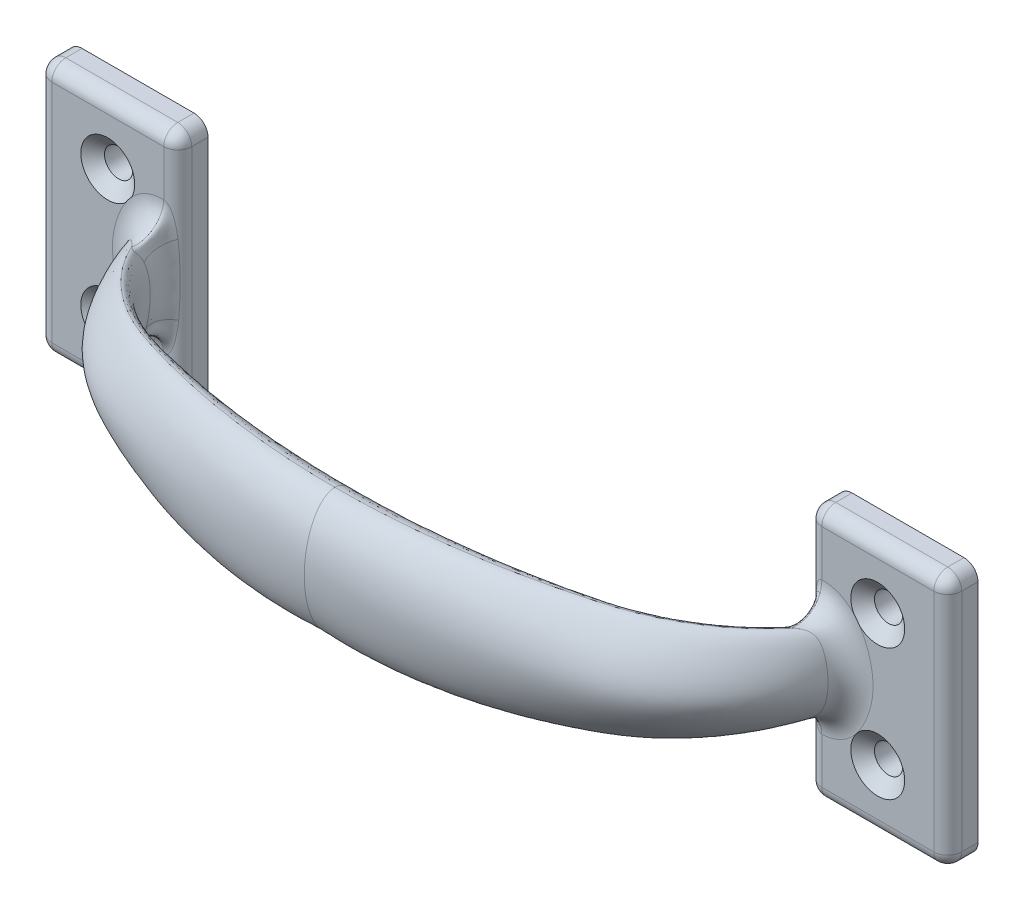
SolidWorks part; units mm, degrees
ref_plane "Front Plane" through (0, 0, 0) normal (0, 0, 1) x (1, 0, 0)
ref_plane "Top Plane" through (0, 0, 0) normal (0, 1, 0) x (1, 0, 0)
ref_plane "Right Plane" through (0, 0, 0) normal (1, 0, 0) x (0, 0, -1)
imported_body "Imported3"
sketch "Sketch1" plane through (0, 12.132, 0) normal (0, 1, 0) x (-1, 0, 0)
  line L0 (69.0098, 2.9464) -> (57.15, 2.9464)
  line L1 (59.69, 5.4864) -> (69.0098, 5.4864)
  line L2 (69.0098, 5.4864) -> (69.0098, 2.9464)
  arc A0 (57.15, 2.9464) -> (59.69, 5.4864) centre (59.69, 2.9464) cw
extrude "Boss-Extrude1" add sketch "Sketch1" along normal blind 10.8867
sketch "Sketch2" plane through (0, -12.1357, 0) normal (0, -1, 0) x (1, 0, 0)
  line L0 (-69.0098, 5.4864) -> (-59.69, 5.4864)
  line L1 (-57.15, 2.9464) -> (-69.0098, 2.9464)
  line L2 (-69.0098, 2.9464) -> (-69.0098, 5.4864)
  arc A0 (-59.69, 5.4864) -> (-57.15, 2.9464) centre (-59.69, 2.9464) cw
extrude "Boss-Extrude2" add sketch "Sketch2" along normal blind 10.8831
sketch "Sketch3" plane through (69.0091, 0, 0) normal (1, 0, 0) x (0, 0, -1)
  line L0 (-5.4864, -12.1357) -> (-5.4864, 12.132)
  line L1 (-5.4864, 12.132) -> (-2.9464, 12.132)
  line L2 (-2.9464, 12.132) -> (-2.9464, -12.1357)
  line L3 (-2.9464, -12.1357) -> (-5.4864, -12.1357)
extrude "Boss-Extrude3" add sketch "Sketch3" along normal blind 13.5409
sketch "Sketch4" plane through (0, -12.1357, 0) normal (0, -1, 0) x (1, 0, 0)
  line L0 (59.69, 5.4864) -> (82.55, 5.4864)
  line L1 (82.55, 5.4864) -> (82.55, 2.9464)
  line L2 (82.55, 2.9464) -> (57.15, 2.9464)
  arc A0 (57.15, 2.9464) -> (59.69, 5.4864) centre (59.69, 2.9464) cw
extrude "Boss-Extrude4" add sketch "Sketch4" along normal blind 10.8831
sketch "Sketch5" plane through (-69.0098, 0, 0) normal (-1, 0, 0) x (0, 0, 1)
  line L0 (2.9464, 23.0188) -> (5.4864, 23.0188)
  line L1 (5.4864, 23.0188) -> (5.4864, -23.0188)
  line L2 (5.4864, -23.0188) -> (2.9464, -23.0188)
  line L3 (2.9464, -23.0188) -> (2.9464, 23.0188)
extrude "Boss-Extrude5" add sketch "Sketch5" along normal blind 13.5402
sketch "Sketch6" plane through (0, 0, 2.9464) normal (0, 0, -1) x (-1, 0, 0)
  line L0 (57.15, 23.0188) -> (82.55, 23.0188)
  line L1 (82.55, 23.0188) -> (82.55, -23.0188)
  line L2 (82.55, -23.0188) -> (57.15, -23.0188)
  line L3 (57.15, -23.0188) -> (57.15, 23.0188)
extrude "Boss-Extrude6" add sketch "Sketch6" along normal blind 2.9464
sketch "Sketch7" plane through (0, 12.132, 0) normal (0, 1, 0) x (-1, 0, 0)
  line L0 (-82.55, 2.9464) -> (-82.55, 5.4864)
  line L1 (-82.55, 5.4864) -> (-59.69, 5.4864)
  line L2 (-57.15, 2.9464) -> (-82.55, 2.9464)
  arc A0 (-59.69, 5.4864) -> (-57.15, 2.9464) centre (-59.69, 2.9464) cw
extrude "Boss-Extrude7" add sketch "Sketch7" along normal blind 10.8867
sketch "Sketch8" plane through (0, 0, 2.9464) normal (0, 0, -1) x (-1, 0, 0)
  line L0 (-82.55, 23.0188) -> (-57.15, 23.0188)
  line L1 (-57.15, 23.0188) -> (-57.15, -23.0188)
  line L2 (-57.15, -23.0188) -> (-82.55, -23.0188)
  line L3 (-82.55, -23.0188) -> (-82.55, 23.0188)
extrude "Boss-Extrude8" add sketch "Sketch8" along normal blind 2.9464
hole_wizard "CSK for #10 Flat Head Machine Screw (100)1" positions "Sketch10" profile "Sketch9" countersink size "#10" standard "ANSI Inch"
sketch "Sketch10" plane through (0, 0, 5.4864) normal (0, 0, 1) x (1, 0, 0)
  point P0 (-69.85, -11.9063)
  point P1 (-69.85, 11.9063)
  point P2 (69.85, 11.9063)
  point P3 (69.85, -11.9063)
sketch "Sketch9" plane through (-69.85, -11.9063, 5.4864) normal (1, 0, 0) x (0, -1, 0)
  line L0 (0, 0) -> (0, 5.4864)
  line L1 (0, 5.4864) -> (2.5527, 5.4864)
  line L2 (2.5527, 5.4864) -> (2.5527, 1.9608)
  line L3 (2.5527, 1.9608) -> (4.8895, 0)
  line L5 (4.8895, 0) -> (0, 0)
  line L6 (-2.5527, 1.9608) -> (-4.8895, 0) construction
  line L11 (0, -6.35) -> (0, 107.95) construction
  dimension "Thru Hole Dia." = 5.1054
  dimension "Thru Hole Depth" = 5.4864
  dimension "Near C'Sink Dia." = 9.779
  dimension "Near C'Sink Angle" = 100
fillet "Fillet1" radius 2.54 18 edges at (57.8939, -23.0188, 4.7425) (57.8939, 23.0188, 4.7425) (-57.8939, 23.0188, 4.7425) (-57.8939, -23.0188, 4.7425) (82.55, -23.0188, 2.7432) (57.15, -23.0188, 1.4732) (71.12, -23.0188, 5.4864) (82.55, 23.0188, 2.7432) (82.55, 0, 5.4864) (71.12, 23.0188, 5.4864) (57.15, 23.0188, 1.4732) (-82.55, 23.0188, 2.7432) (-82.55, 0, 5.4864) (-82.55, -23.0188, 2.7432) (-57.15, 23.0188, 1.4732) (-71.12, 23.0188, 5.4864) (-71.12, -23.0188, 5.4864) (-57.15, -23.0188, 1.4732)
